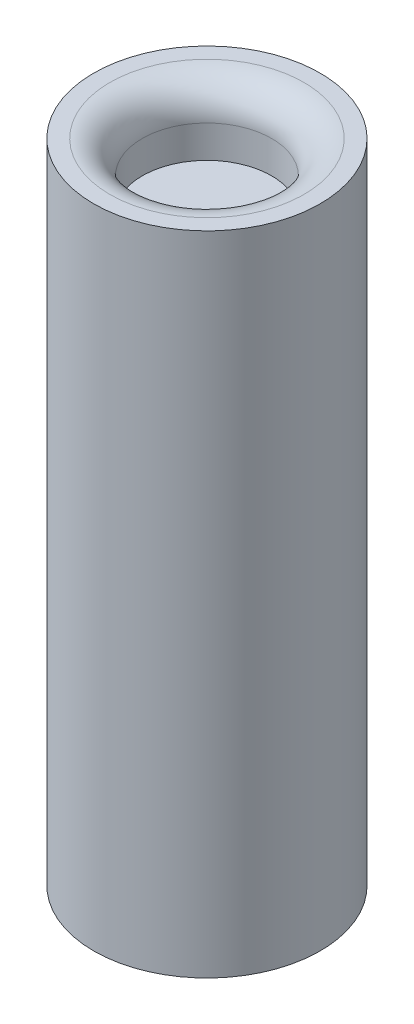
SolidWorks part; units mm, degrees
ref_plane "Alzado" through (0, 0, 0) normal (0, 0, 1) x (1, 0, 0)
ref_plane "Planta" through (0, 0, 0) normal (0, 1, 0) x (1, 0, 0)
ref_plane "Vista lateral" through (0, 0, 0) normal (1, 0, 0) x (0, 0, -1)
sketch "Croquis1" plane through (0, 0, 0) normal (0, 1, 0) x (1, 0, 0)
  circle A0 centre (0, 0) radius 17.5
  dimension "D1" = 35
extrude "Saliente-Extruir1" add sketch "Croquis1" along normal blind 100
sketch "Croquis2" plane through (0, 100, 0) normal (0, 1, 0) x (1, 0, 0)
  circle A0 centre (0, 0) radius 10
  dimension "D1" = 20
extrude "Cortar-Extruir2" cut sketch "Croquis2" against normal blind 10
fillet "Redondeo2" radius 5 1 edges at (0, 100, 10)
